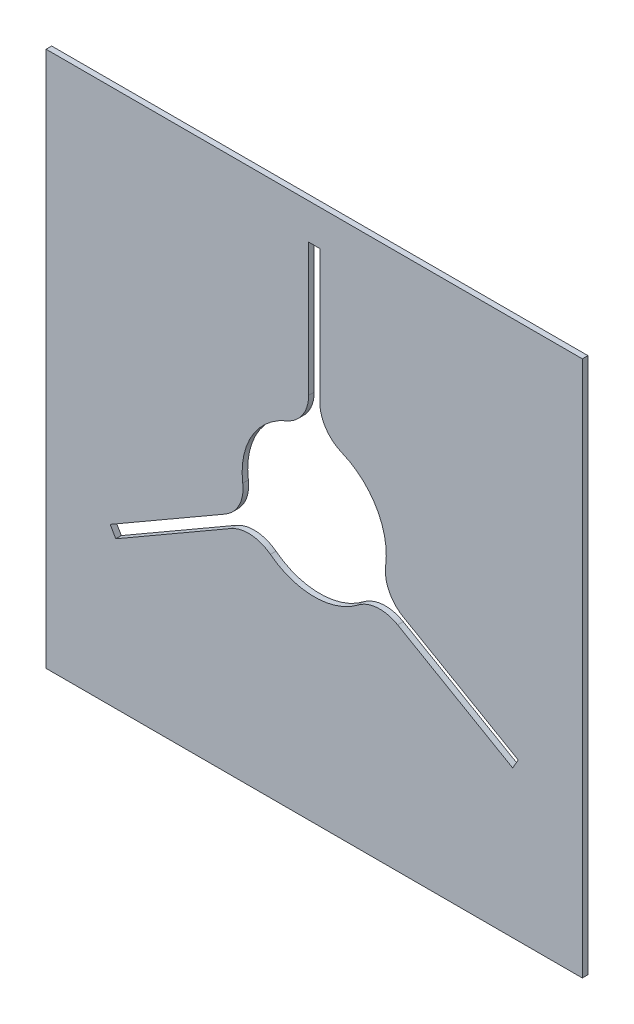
SolidWorks part; units mm, degrees
ref_plane "Front Plane" through (0, 0, 0) normal (0, 0, 1) x (1, 0, 0)
ref_plane "Top Plane" through (0, 0, 0) normal (0, 1, 0) x (1, 0, 0)
ref_plane "Right Plane" through (0, 0, 0) normal (1, 0, 0) x (0, 0, -1)
sketch "Sketch1" plane through (0, 0, 0) normal (0, 0, 1) x (1, 0, 0)
  line L1 (-76.2, 76.2) -> (76.2, 76.2)
  line L2 (-76.2, 76.2) -> (-76.2, -76.2)
  line L3 (-76.2, -76.2) -> (76.2, -76.2)
  line L4 (76.2, 76.2) -> (76.2, -76.2)
  line L5 (-76.2, 76.2) -> (76.2, -76.2) construction
  line L6 (-76.2, -76.2) -> (76.2, 76.2) construction
  point P0 (0, 0)
  dimension "D1" = 152.4
  dimension "D2" = 152.4
extrude "Boss-Extrude1" add sketch "Sketch1" along normal blind 1.5875
sketch "Sketch3" plane through (0, 0, 1.5875) normal (0, 0, 1) x (1, 0, 0)
  circle A0 centre (0, 0) radius 20.4851
  dimension "D1" = 40.9702
extrude "Cut-Extrude2" cut sketch "Sketch3" against normal through all
sketch "Sketch4" plane through (0, 0, 1.5875) normal (0, 0, 1) x (1, 0, 0)
  line L0 (0, 0) -> (0, 76.2) construction
  line L1 (76.2, 76.2) -> (-76.2, 76.2) construction
  line L3 (-1.5875, 66.04) -> (1.5875, 66.04)
  line L4 (-1.5875, 66.04) -> (-1.5875, 0)
  line L5 (-1.5875, 0) -> (1.5875, 0)
  line L6 (1.5875, 66.04) -> (1.5875, 0)
  line L7 (-1.5875, 66.04) -> (1.5875, 0) construction
  line L8 (-1.5875, 0) -> (1.5875, 66.04) construction
  point P5 (0, 33.02)
  dimension "D1" = 3.175
  dimension "D2" = 33.02
  dimension "D3" = 66.04
extrude "Cut-Extrude3" cut sketch "Sketch4" against normal through all
fillet "Fillet1" radius 10.16 2 edges at (1.5875, 20.4235, 0.7937) (-1.5875, 20.4235, 0.7937)
pattern_circular "CirPattern2" count 3 over 360 about axis through (0, 0, 0) along (0, 0, 1) of "Cut-Extrude3", "Fillet1"
sketch "Sketch5" plane through (0, 0, 1.5875) normal (0, 0, 1) x (1, 0, 0)
  line L8 (76.454, -76.454) -> (76.454, 76.454)
  line L9 (76.454, 76.454) -> (-76.454, 76.454)
  line L10 (-76.454, 76.454) -> (-76.454, -76.454)
  line L11 (-76.454, -76.454) -> (76.454, -76.454)
  line L12 (76.454, -76.454) -> (76.454, 76.454)
  line L13 (76.454, 76.454) -> (-76.454, 76.454)
  line L14 (-76.454, 76.454) -> (-76.454, -76.454)
  line L15 (-76.454, -76.454) -> (76.454, -76.454)
  line L39 (-57.6391, -31.7382) -> (-56.3056, -34.0478)
  line L40 (57.6391, -31.7382) -> (25.1788, -12.9972)
  line L41 (56.3056, -34.0478) -> (57.6391, -31.7382)
  line L42 (23.8453, -15.3069) -> (56.3056, -34.0478)
  line L43 (-56.3056, -34.0478) -> (-23.8453, -15.3069)
  line L44 (-25.1788, -12.9972) -> (-57.6391, -31.7382)
  line L45 (1.3335, 28.304) -> (1.3335, 65.786)
  line L46 (1.3335, 65.786) -> (-1.3335, 65.786)
  line L47 (-1.3335, 65.786) -> (-1.3335, 28.304)
  line L48 (-57.6391, -31.7382) -> (-56.3056, -34.0478)
  line L49 (57.6391, -31.7382) -> (25.1788, -12.9972)
  line L50 (56.3056, -34.0478) -> (57.6391, -31.7382)
  line L51 (23.8453, -15.3069) -> (56.3056, -34.0478)
  line L52 (-56.3056, -34.0478) -> (-23.8453, -15.3069)
  line L53 (-25.1788, -12.9972) -> (-57.6391, -31.7382)
  line L54 (1.3335, 28.304) -> (1.3335, 65.786)
  line L55 (1.3335, 65.786) -> (-1.3335, 65.786)
  line L56 (-1.3335, 65.786) -> (-1.3335, 28.304)
  arc A27 (20.0599, -2.6264) -> (7.7554, 18.6856) centre (0, 0) ccw
  arc A28 (20.0599, -2.6264) -> (25.1788, -12.9972) centre (30.3858, -3.9784) ccw
  arc A29 (23.8453, -15.3069) -> (12.3045, -16.0592) centre (18.6383, -24.3257) ccw
  arc A30 (-12.3045, -16.0592) -> (12.3045, -16.0592) centre (0, 0) ccw
  arc A31 (-12.3045, -16.0592) -> (-23.8453, -15.3069) centre (-18.6383, -24.3257) ccw
  arc A32 (-25.1788, -12.9972) -> (-20.0599, -2.6264) centre (-30.3858, -3.9784) ccw
  arc A33 (-7.7554, 18.6856) -> (-20.0599, -2.6264) centre (0, 0) ccw
  arc A34 (1.3335, 28.304) -> (7.7554, 18.6856) centre (11.7475, 28.304) ccw
  arc A35 (-7.7554, 18.6856) -> (-1.3335, 28.304) centre (-11.7475, 28.304) ccw
  arc A36 (20.0599, -2.6264) -> (7.7554, 18.6856) centre (0, 0) ccw
  arc A37 (20.0599, -2.6264) -> (25.1788, -12.9972) centre (30.3858, -3.9784) ccw
  arc A38 (23.8453, -15.3069) -> (12.3045, -16.0592) centre (18.6383, -24.3257) ccw
  arc A39 (-12.3045, -16.0592) -> (12.3045, -16.0592) centre (0, 0) ccw
  arc A40 (-12.3045, -16.0592) -> (-23.8453, -15.3069) centre (-18.6383, -24.3257) ccw
  arc A41 (-25.1788, -12.9972) -> (-20.0599, -2.6264) centre (-30.3858, -3.9784) ccw
  arc A42 (-7.7554, 18.6856) -> (-20.0599, -2.6264) centre (0, 0) ccw
  arc A43 (1.3335, 28.304) -> (7.7554, 18.6856) centre (11.7475, 28.304) ccw
  arc A44 (-7.7554, 18.6856) -> (-1.3335, 28.304) centre (-11.7475, 28.304) ccw
  dimension "D1" = 0.254
  dimension "D2" = 0.254
